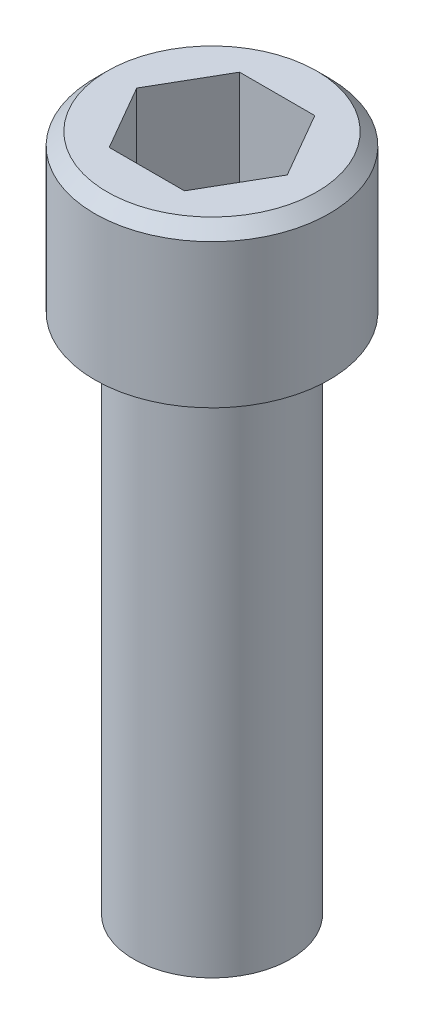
SolidWorks part; units mm, degrees
ref_plane "Plane1" through (0, 0, 0) normal (0, 0, 1) x (1, 0, 0)
ref_plane "Plane2" through (0, 0, 0) normal (0, 1, 0) x (1, 0, 0)
ref_plane "Plane3" through (0, 0, 0) normal (1, 0, 0) x (0, 0, -1)
sketch "Sketch1" plane through (0, 0, 0) normal (0, 0, 1) x (1, 0, 0)
  line L0 (0, 0) -> (0, 43.6223) construction
  line L1 (4.7625, 0) -> (7.1437, 0)
  line L2 (7.1437, 0) -> (7.1437, 9.525)
  line L3 (7.1437, 9.525) -> (0, 9.525)
  line L4 (0, 9.525) -> (0, -31.75)
  line L5 (0, -31.75) -> (4.7625, -31.75)
  line L6 (4.7625, -31.75) -> (4.7625, 0)
  line L7 (50, 0) -> (-50, 0) construction
  dimension "D1" = 14.2875
  dimension "D2" = 9.525
  dimension "D3" = 9.525
  dimension "D4" = 31.75
revolve "Base-Revolve" add sketch "Sketch1" angle 360 about L0
sketch "Sketch2" plane through (0, 9.525, 0) normal (0, 1, 0) x (-1, 0, 0)
  line L0 (2.2914, -3.9688) -> (-2.2914, -3.9688)
  line L1 (-4.5827, 0) -> (-2.2914, -3.9688)
  line L2 (0, 0) -> (0, -3.9688) construction
  line L3 (0, 0) -> (-4.5827, 0) construction
  line L4 (4.5827, 0) -> (2.2914, -3.9688)
  line L5 (4.5827, 0) -> (2.2914, 3.9688)
  line L6 (-4.5827, 0) -> (-2.2914, 3.9688)
  line L7 (2.2914, 3.9688) -> (-2.2914, 3.9688)
  circle A0 centre (0, 0) radius 3.9688 construction
  point P12 (0, -3.9688)
  point P14 (0, 3.9688)
  dimension "D2" = 7.9375
extrude "Cut-Extrude1" cut sketch "Sketch2" against normal blind 6.35
chamfer "Chamfer1" distance 0.762 angle 45 1 edges at (0, 9.525, -7.1437)
chamfer "Chamfer2" distance 0.762 angle 45
